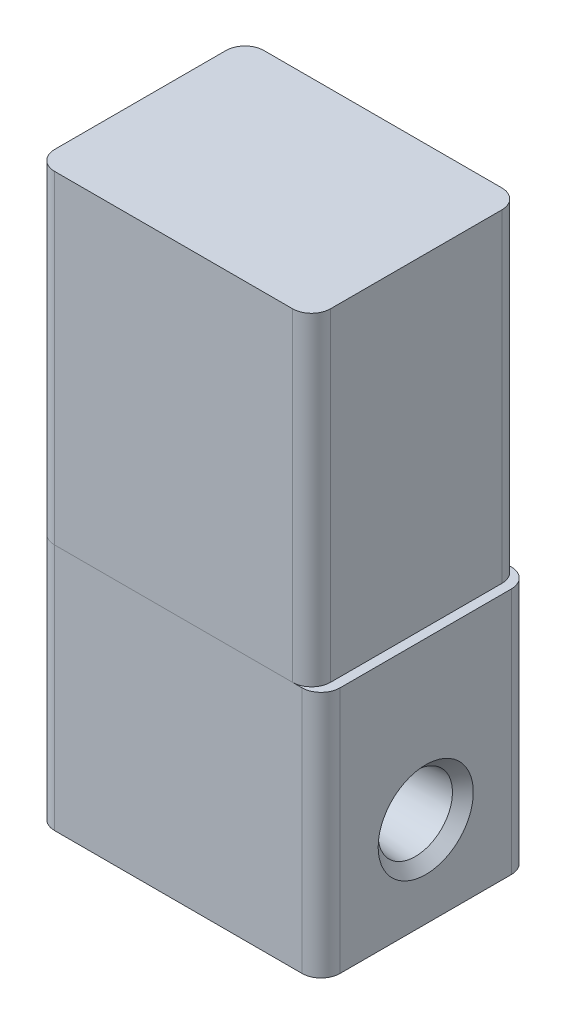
SolidWorks part; units mm, degrees
ref_plane "Front Plane" through (0, 0, 0) normal (0, 0, 1) x (1, 0, 0)
ref_plane "Top Plane" through (0, 0, 0) normal (0, 1, 0) x (1, 0, 0)
ref_plane "Right Plane" through (0, 0, 0) normal (1, 0, 0) x (0, 0, -1)
sketch "Sketch1" plane through (0, 0, 0) normal (0, 1, 0) x (1, 0, 0)
  line L1 (-15, -11) -> (15, -11)
  line L2 (-15, -11) -> (-15, 11)
  line L3 (-15, 11) -> (15, 11)
  line L4 (15, -11) -> (15, 11)
  line L5 (-15, -11) -> (15, 11) construction
  line L6 (-15, 11) -> (15, -11) construction
  point P0 (0, 0)
  dimension "D1" = 30
  dimension "D2" = 22
extrude "Boss-Extrude1" add sketch "Sketch1" along normal blind 26
sketch "Sketch2" plane through (0, 0, 0) normal (0, -1, 0) x (1, 0, 0)
  line L0 (10, 7.5) -> (10, -7.5) construction
  line L1 (0, 0) -> (10, 0) construction
  line L2 (15, 11) -> (15, -11) construction
  circle A0 centre (10, 7.5) radius 2
  circle A1 centre (10, -7.5) radius 2
  dimension "D1" = 4
  dimension "D2" = 15
  dimension "D3" = 5
extrude "Cut-Extrude1" cut sketch "Sketch2" against normal blind 4
sketch "Sketch5" plane through (15, 0, 0) normal (1, 0, 0) x (0, 0, -1)
  line L0 (0, 9.5) -> (0, 0) construction
  circle A0 centre (0, 9.5) radius 4
  dimension "D2" = 8
  dimension "D1" = 9.5
extrude "Cut-Extrude2" cut sketch "Sketch5" against normal blind 10 draft 5
mirror "Mirror2" about plane through (0, 0, 0) normal (1, 0, 0) of "Cut-Extrude2"
chamfer "Chamfer1" distance 1 angle 45 4 edges at (15, 9.5, -4) (5, 9.5, -3.1251) (-15, 9.5, -4) (-5, 9.5, 3.1251)
fillet "Fillet1" radius 2 4 edges at (-15, 13, -11) (-15, 13, 11) (15, 13, -11) (15, 13, 11)
sketch "Sketch6" plane through (0, 26, 0) normal (0, 1, 0) x (1, 0, 0)
  line L0 (-15, 9) -> (-15, -9) construction
  line L1 (14, -11) -> (-15, -11)
  line L2 (14, -11) -> (14, 11)
  line L3 (14, 11) -> (-15, 11)
  line L4 (-15, -11) -> (-15, 11)
  line L5 (14, -11) -> (-15, 11) construction
  line L6 (14, 11) -> (-15, -11) construction
  line L7 (13, 11) -> (-13, 11) construction
  line L8 (-13, -11) -> (13, -11) construction
  line L9 (15, -9) -> (15, 9) construction
  point P0 (-0.5, 0)
  dimension "D1" = 1
extrude "Boss-Extrude2" add sketch "Sketch6" along normal blind 34 separate body
fillet "Fillet2" radius 2 4 edges at (14, 43, -11) (14, 43, 11) (-15, 43, -11) (-15, 43, 11)
